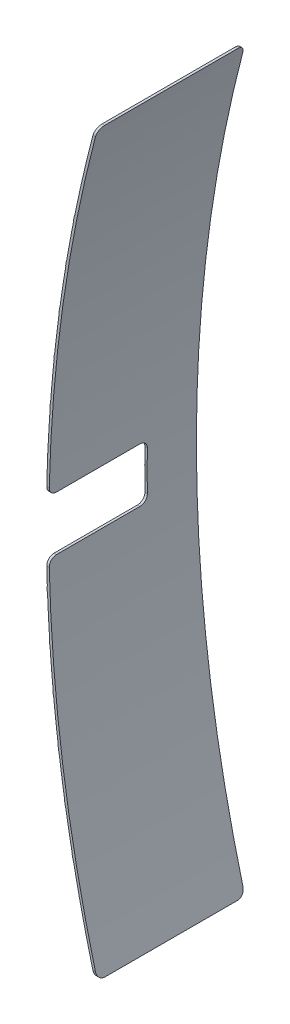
SolidWorks part; units mm, degrees
ref_plane "前视基准面" through (0, 0, 0) normal (0, 0, 1) x (1, 0, 0)
ref_plane "上视基准面" through (0, 0, 0) normal (0, 1, 0) x (1, 0, 0)
ref_plane "右视基准面" through (0, 0, 0) normal (1, 0, 0) x (0, 0, -1)
sketch "草图1" plane through (0, 0, 0) normal (0, 0, 1) x (1, 0, 0)
  line L0 (-56.1303, 15) -> (-56.0268, 15)
  line L1 (-56.1303, -15) -> (-56.0268, -15)
  line L2 (-1000, 0) -> (49000, 0) construction
  arc A0 (-56.1303, 15) -> (-56.1303, -15) centre (0, 0) ccw
  arc A1 (-56.0268, 15) -> (-56.0268, -15) centre (0, 0) ccw
  dimension "D1" = 116.2
  dimension "D2" = 116
  dimension "D3" = 30
extrude "凸台-拉伸1" add sketch "草图1" along normal blind 6
ref_plane "基准面1" through (-50, 0, 0) normal (1, 0, 0) x (0, 0, -1)
sketch "草图4" plane through (0, 0, 0) normal (1, 0, 0) x (0, 0, -1)
  line L0 (-6, -1.1) -> (-2, -1.1)
  line L1 (-6, 15) -> (-6, -15) construction
  line L2 (-2, -1.1) -> (-2, 1.1)
  line L3 (-2, 1.1) -> (-6, 1.1)
  line L4 (-6, 1.1) -> (-6, -1.1)
  line L5 (-1000, 0) -> (49000, 0) construction
  dimension "D1" = 4
  dimension "D2" = 2.2
extrude "切除-拉伸1" cut sketch "草图4" against normal through all
fillet "圆角1" radius 0.3 8 edges at (-56.0785, -15, 6) (-56.0785, -15, 0) (-56.0785, 15, 6) (-56.0785, 15, 0) (-58.0396, -1.1, 2) (-58.0396, 1.1, 2) (-58.0396, 1.1, 6) (-58.0396, -1.1, 6)
sketch "草图5" plane through (-50, 0, 0) normal (1, 0, 0) x (0, 0, -1)
  line L0 (0, -2.8572) -> (0, 3.1428)
  line L1 (0, 3.1428) -> (-2, 0.1428)
  line L2 (-2, 0.1428) -> (0, -2.8572)
  line L3 (-1002, 0.1428) -> (48998, 0.1428) construction
  line L4 (0, -14.7) -> (0, 14.7) construction
  line L5 (-2, 0.8) -> (-2, -0.8) construction
  line L6 (-6, -1.4) -> (-6, -14.7) construction
  line L7 (-6, -2.3) -> (-2, -2.3)
  line L8 (-6, -2.3) -> (-6, -2.1)
  line L9 (-6, -2.1) -> (-2, -2.1)
  line L10 (-2, -2.3) -> (-2, -2.1)
  line L31 (-5.7, -1.1) -> (-2.3, -1.1) construction
  line L56 (-6, -4.1) -> (-2, -4.1)
  line L57 (-6, -4.1) -> (-6, -3.9)
  line L58 (-6, -3.9) -> (-2, -3.9)
  line L59 (-2, -4.1) -> (-2, -3.9)
  line L60 (-6, -5.9) -> (-2, -5.9)
  line L61 (-6, -5.9) -> (-6, -5.7)
  line L62 (-6, -5.7) -> (-2, -5.7)
  line L63 (-2, -5.9) -> (-2, -5.7)
  line L64 (-6, -7.7) -> (-2, -7.7)
  line L65 (-6, -7.7) -> (-6, -7.5)
  line L66 (-6, -7.5) -> (-2, -7.5)
  line L67 (-2, -7.7) -> (-2, -7.5)
  line L68 (-6, -9.5) -> (-2, -9.5)
  line L69 (-6, -9.5) -> (-6, -9.3)
  line L70 (-6, -9.3) -> (-2, -9.3)
  line L71 (-2, -9.5) -> (-2, -9.3)
  line L72 (-6, -11.3) -> (-2, -11.3)
  line L73 (-6, -11.3) -> (-6, -11.1)
  line L74 (-6, -11.1) -> (-2, -11.1)
  line L75 (-2, -11.3) -> (-2, -11.1)
  line L76 (-6, -2.3) -> (-6, -4.1) construction
  line L77 (-6, 2.5855) -> (-6, 4.3855) construction
  line L78 (-2, 11.5855) -> (-2, 11.3855)
  line L79 (-6, 11.3855) -> (-2, 11.3855)
  line L80 (-6, 11.5855) -> (-6, 11.3855)
  line L81 (-6, 11.5855) -> (-2, 11.5855)
  line L82 (-2, 9.7855) -> (-2, 9.5855)
  line L83 (-6, 9.5855) -> (-2, 9.5855)
  line L84 (-6, 9.7855) -> (-6, 9.5855)
  line L85 (-6, 9.7855) -> (-2, 9.7855)
  line L86 (-2, 7.9855) -> (-2, 7.7855)
  line L87 (-6, 7.7855) -> (-2, 7.7855)
  line L88 (-6, 7.9855) -> (-6, 7.7855)
  line L89 (-6, 7.9855) -> (-2, 7.9855)
  line L90 (-2, 6.1855) -> (-2, 5.9855)
  line L91 (-6, 5.9855) -> (-2, 5.9855)
  line L92 (-6, 6.1855) -> (-6, 5.9855)
  line L93 (-6, 6.1855) -> (-2, 6.1855)
  line L94 (-2, 4.3855) -> (-2, 4.1855)
  line L95 (-6, 4.1855) -> (-2, 4.1855)
  line L96 (-6, 4.3855) -> (-6, 4.1855)
  line L97 (-6, 4.3855) -> (-2, 4.3855)
  line L98 (-2, 2.5855) -> (-2, 2.3855)
  line L99 (-6, 2.3855) -> (-2, 2.3855)
  line L100 (-6, 2.5855) -> (-6, 2.3855)
  line L101 (-6, 2.5855) -> (-2, 2.5855)
  line L116 (-5.7, 15) -> (-0.3, 15) construction
  line L117 (-4.8, 13.5) -> (-3.65, 13.5)
  line L118 (-4.8, 13.5) -> (-4.8, 13.3)
  line L119 (-4.8, 13.3) -> (-3.65, 13.3)
  line L120 (-2.3, 13.5) -> (-2.3, 13.3)
  line L121 (-6, 14.7) -> (-6, 1.4) construction
  line L122 (-3.65, 14.65) -> (-3.45, 14.65)
  line L123 (-3.65, 14.65) -> (-3.65, 13.5)
  line L124 (-3.65, 12.15) -> (-3.45, 12.15)
  line L125 (-3.45, 14.65) -> (-3.45, 13.5)
  line L126 (-5.7, -15) -> (-0.3, -15) construction
  line L127 (-3.65, -12.15) -> (-3.45, -12.15)
  line L128 (-3.65, -12.15) -> (-3.65, -14.65)
  line L129 (-3.65, -14.65) -> (-3.45, -14.65)
  line L130 (-3.45, -12.15) -> (-3.45, -14.65)
  line L131 (-3.45, 13.3) -> (-3.45, 12.15)
  line L132 (-3.45, 13.5) -> (-2.3, 13.5)
  line L133 (-3.65, 13.3) -> (-3.65, 12.15)
  line L134 (-3.45, 13.3) -> (-2.3, 13.3)
  point P81 (-3.65, -13.4)
  dimension "D1" = 6
  dimension "D2" = 0.2
  dimension "D3" = 6
  dimension "D5" = 1
  dimension "D4" = 1.8
  dimension "D6" = 2.5
  dimension "D7" = 0.2
  dimension "D8" = 1.5
  dimension "D9" = 2.5
  dimension "D10" = 0.2
  dimension "D11" = 1.15
  dimension "D12" = 1.15
  dimension "D13" = 1.2
  dimension "D14" = 2.5
  dimension "D15" = 0.2
  dimension "D16" = 0.35
  dimension "D17" = 2.35
wrap "包覆1" sketch "草图5" wrap type emboss source sketch "草图5" thickness 0.01 parameters "D1"=0.01
